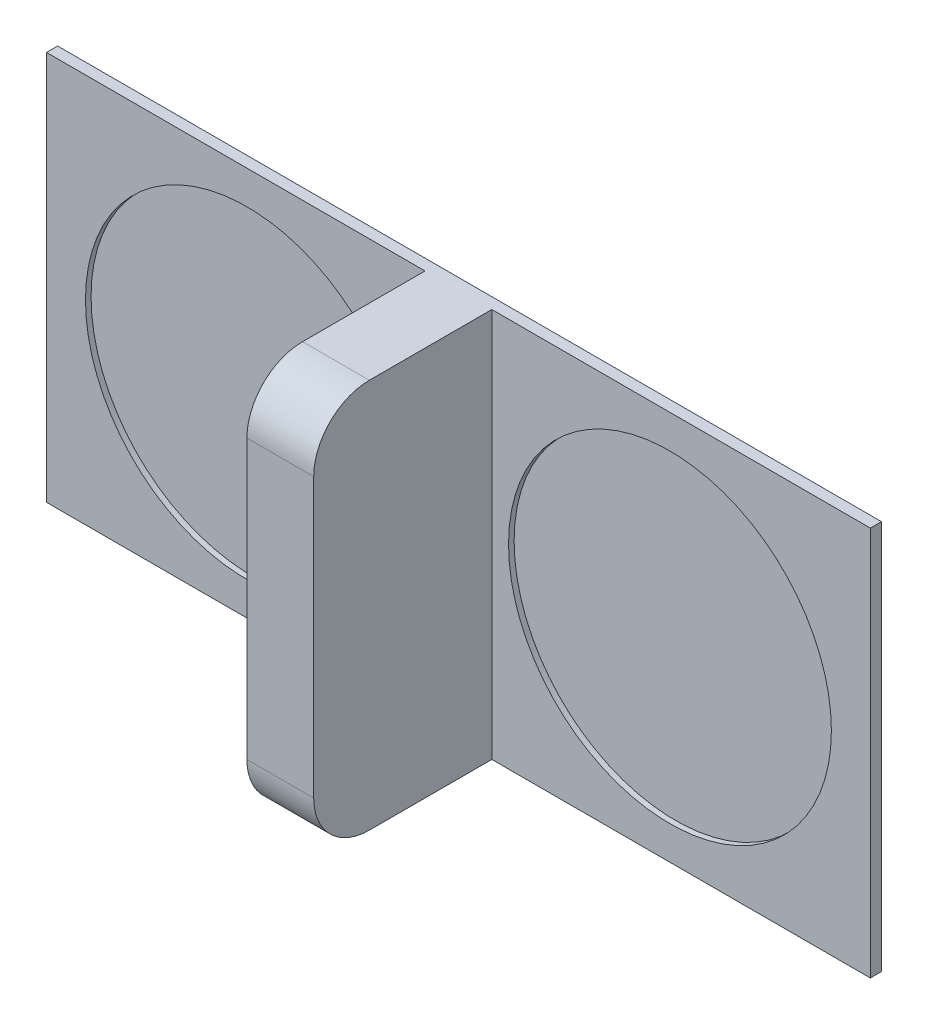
SolidWorks part; units mm, degrees
ref_plane "Front" through (0, 0, 0) normal (0, 0, 1) x (1, 0, 0)
ref_plane "Top" through (0, 0, 0) normal (0, 1, 0) x (1, 0, 0)
ref_plane "Right" through (0, 0, 0) normal (1, 0, 0) x (0, 0, -1)
sketch "Sketch1" plane through (0, 0, 0) normal (0, 0, 1) x (1, 0, 0)
  line L1 (-39.6404, 1.9614) -> (-20.8444, 1.9614)
  line L2 (-39.6404, 1.9614) -> (-39.6404, -6.9286)
  line L3 (-39.6404, -6.9286) -> (-20.8444, -6.9286)
  line L4 (-20.8444, 1.9614) -> (-20.8444, -6.9286)
  dimension "D1" = 18.796
  dimension "D2" = 8.89
extrude "Base-Extrude" add sketch "Sketch1" along normal blind 0.254
sketch "Sketch2" plane through (0, 0, 0.254) normal (0, 0, 1) x (1, 0, 0)
  line L0 (-30.2424, 8.0793) -> (-30.2424, -13.5731) construction
  line L1 (-20.8444, -6.9286) -> (-20.8444, 1.9614) construction
  line L2 (-39.6404, -6.9286) -> (-20.8444, -6.9286) construction
  line L3 (-39.6404, 1.9614) -> (-39.6404, -6.9286) construction
  circle A0 centre (-35.0684, -2.4836) radius 3.683
  circle A1 centre (-25.4164, -2.4836) radius 3.683
  dimension "D1" = 7.366
  dimension "D2" = 7.366
  dimension "D3" = 9.652
  dimension "D5" = 4.445
extrude "Cut-Extrude1" cut sketch "Sketch2" against normal blind 0.127
sketch "Sketch3" plane through (0, 0, 0.254) normal (0, 0, 1) x (1, 0, 0)
  line L0 (-39.6404, -6.9286) -> (-20.8444, -6.9286) construction
  line L1 (-29.4804, -6.9286) -> (-31.0044, -6.9286)
  line L2 (-29.4804, -6.9286) -> (-29.4804, 1.9614)
  line L3 (-29.4804, 1.9614) -> (-31.0044, 1.9614)
  line L4 (-31.0044, -6.9286) -> (-31.0044, 1.9614)
  line L5 (-20.8444, 1.9614) -> (-39.6404, 1.9614) construction
  line L6 (-20.8444, -6.9286) -> (-20.8444, 1.9614) construction
  line L7 (-30.2424, 5.0334) -> (-30.2424, -10.9907) construction
  line L8 (-39.6404, 1.9614) -> (-39.6404, -6.9286) construction
  dimension "D1" = 1.524
extrude "Boss-Extrude1" add sketch "Sketch3" along normal blind 4.064
fillet "Fillet1" radius 1.27
